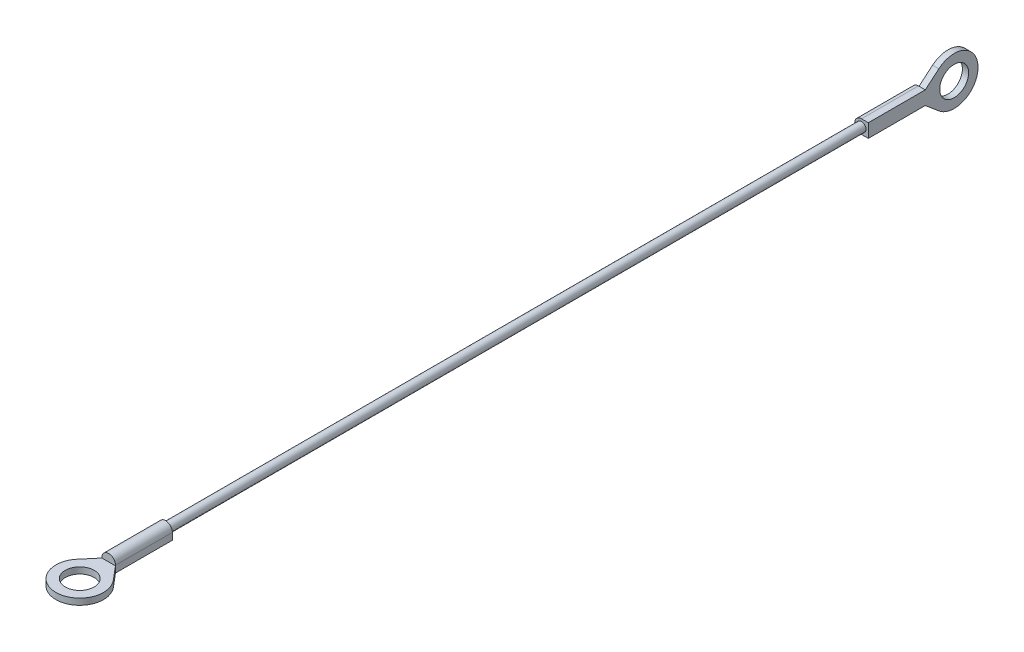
SolidWorks part; units mm, degrees
ref_plane "Front Plane" through (0, 0, 0) normal (0, 0, 1) x (1, 0, 0)
ref_plane "Top Plane" through (0, 0, 0) normal (0, 1, 0) x (1, 0, 0)
ref_plane "Right Plane" through (0, 0, 0) normal (1, 0, 0) x (0, 0, -1)
sketch "Sketch1" plane through (0, 0, 0) normal (0, 0, 1) x (1, 0, 0)
  circle A0 centre (0, 0) radius 0.795
extrude "Boss-Extrude1" add sketch "Sketch1" along normal mid plane 122.24
sketch "Sketch2" plane through (0, 0, 61.12) normal (0, 0, 1) x (1, 0, 0)
  line L0 (-1.195, 0) -> (-1.195, -1.195)
  line L1 (-1.195, -1.195) -> (0, -1.195)
  line L2 (0, -1.195) -> (1.195, -1.195)
  line L3 (1.195, -1.195) -> (1.195, 0)
  arc A0 (1.195, 0) -> (-1.195, 0) centre (0, 0) ccw
  dimension "D1" = 2.39
extrude "Boss-Extrude2" add sketch "Sketch2" along normal blind 10
sketch "Sketch3" plane through (0, -1.195, 0) normal (0, -1, 0) x (1, 0, 0)
  line L0 (1.195, 71.12) -> (3.2017, 73.4972)
  line L1 (-3.2017, 73.4972) -> (-1.195, 71.12)
  line L2 (-1.195, 71.12) -> (1.195, 71.12)
  arc A0 (3.2017, 73.4972) -> (-3.2017, 73.4972) centre (0, 76.2) ccw
  circle A1 centre (0, 76.2) radius 2.54
  point P8 (4.19, 76.2)
  point P9 (-4.19, 76.2)
  dimension "D1" = 5.08
  dimension "D2" = 8.38
  dimension "D3" = 76.2
extrude "Boss-Extrude3" add sketch "Sketch3" against normal blind 1.1
sketch "Sketch4" plane through (0, 0, -61.12) normal (0, 0, -1) x (-1, 0, 0)
  line L0 (0, 1.195) -> (-1.195, 1.195)
  line L1 (-1.195, 1.195) -> (-1.195, 0)
  line L2 (-1.195, 0) -> (-1.195, -1.195)
  line L3 (-1.195, -1.195) -> (0, -1.195)
  arc A0 (0, -1.195) -> (0, 1.195) centre (0, 0) ccw
  dimension "D1" = 2.39
extrude "Boss-Extrude4" add sketch "Sketch4" along normal blind 10
sketch "Sketch5" plane through (1.195, 0, 0) normal (1, 0, 0) x (0, 0, -1)
  line L0 (71.12, -1.195) -> (71.12, 1.195)
  line L1 (71.12, 1.195) -> (73.4972, 3.2017)
  line L2 (73.4972, -3.2017) -> (71.12, -1.195)
  arc A0 (73.4972, 3.2017) -> (73.4972, -3.2017) centre (76.2, 0) cw
  circle A1 centre (76.2, 0) radius 2.54
  point P8 (76.2, 4.19)
  point P9 (76.2, -4.19)
  dimension "D1" = 5.08
  dimension "D2" = 8.38
  dimension "D3" = 76.2
extrude "Boss-Extrude5" add sketch "Sketch5" against normal blind 1.1
